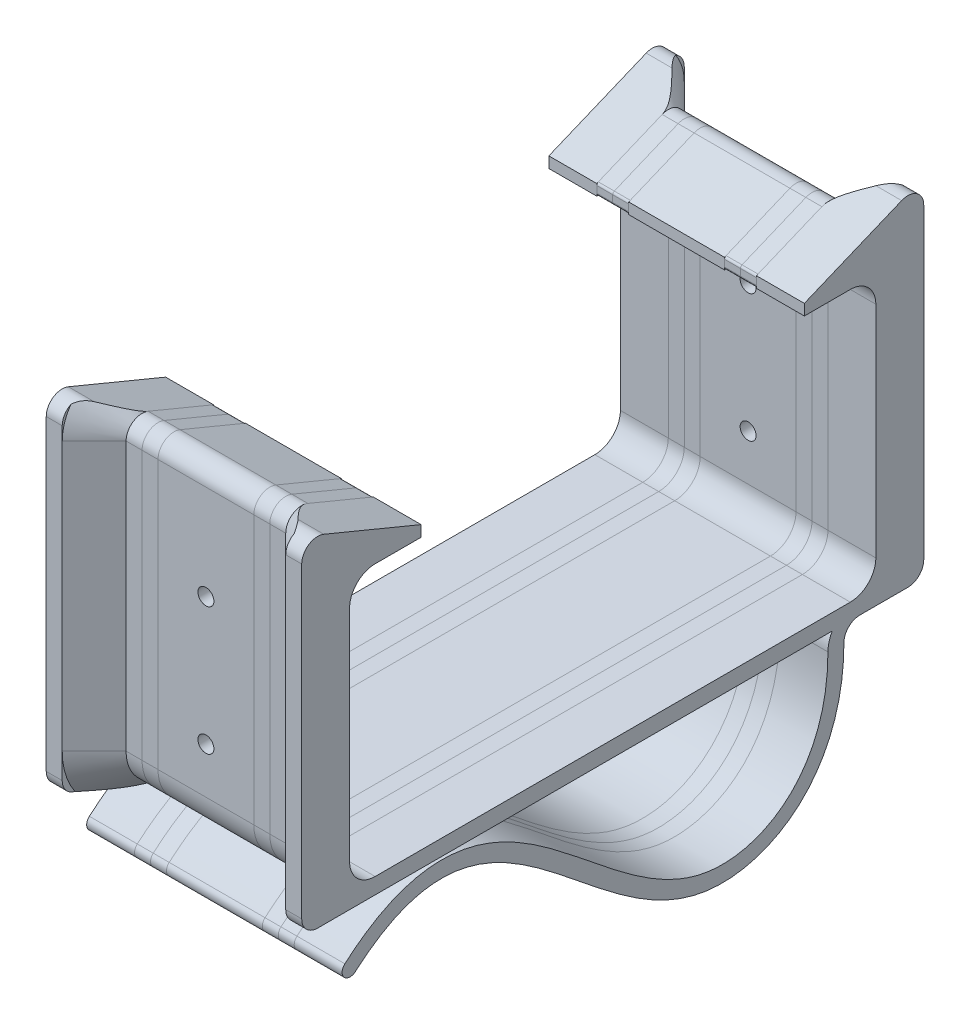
SolidWorks part; units mm, degrees
other "Markup1"
sketch "Sketch7" plane through (-12.7, 17.7179, -30.1625) normal (-0.2414, 0.8298, -0.5031) x (-0.9244, -0.0389, 0.3793)
ref_plane "Front Plane" through (0, 0, 0) normal (0, 0, 1) x (1, 0, 0)
ref_plane "Top Plane" through (0, 0, 0) normal (0, 1, 0) x (1, 0, 0)
ref_plane "Right Plane" through (0, 0, 0) normal (1, 0, 0) x (0, 0, -1)
sketch "Sketch1" plane through (0, 0, 0) normal (1, 0, 0) x (0, 0, -1)
  line L0 (-23.622, -13.462) -> (23.622, -13.462)
  line L1 (-26.162, -10.922) -> (-26.162, 10.922)
  line L2 (-23.622, 13.462) -> (23.622, 13.462)
  line L3 (26.162, -10.922) -> (26.162, 10.922)
  line L4 (-26.162, -13.462) -> (26.162, 13.462) construction
  line L5 (-26.162, 13.462) -> (26.162, -13.462) construction
  arc A0 (-23.622, -13.462) -> (-26.162, -10.922) centre (-23.622, -10.922) cw
  arc A1 (23.622, -13.462) -> (26.162, -10.922) centre (23.622, -10.922) ccw
  arc A2 (23.622, 13.462) -> (26.162, 10.922) centre (23.622, 10.922) cw
  arc A3 (-26.162, 10.922) -> (-23.622, 13.462) centre (-23.622, 10.922) cw
  point P0 (0, 0)
  dimension "D3" = 2.54
  dimension "D1" = 52.324
  dimension "D2" = 26.924
extrude "Extrude-Thin1" add sketch "Sketch1" along normal mid plane 25.4 thin
sketch "Sketch2" plane through (12.7, 0, 0) normal (1, 0, 0) x (0, 0, -1)
  line L0 (23.622, 13.462) -> (-23.622, 13.462) construction
  line L1 (-19.05, 13.462) -> (19.05, 13.462)
  line L2 (-19.05, 13.462) -> (-19.05, 15.0495)
  line L3 (-19.05, 15.0495) -> (19.05, 15.0495)
  line L4 (19.05, 13.462) -> (19.05, 15.0495)
  line L5 (23.622, 15.0495) -> (-23.622, 15.0495) construction
  point P8 (0, 13.462)
  dimension "D1" = 38.1
extrude "Cut-Extrude1" cut sketch "Sketch2" against normal through all
sketch "Sketch3" plane through (12.7, 0, 0) normal (1, 0, 0) x (0, 0, -1)
  line L0 (-27.7495, 10.922) -> (-27.7495, 19.812)
  line L1 (-27.7495, 19.812) -> (-19.05, 19.812)
  line L2 (-19.05, 19.812) -> (-19.05, 13.462)
  line L3 (27.7495, 10.922) -> (27.7495, 19.812)
  line L4 (27.7495, 19.812) -> (19.05, 19.812)
  line L5 (19.05, 19.812) -> (19.05, 13.462)
  line L6 (-19.05, 15.0495) -> (-19.05, 13.462) construction
  line L7 (19.05, 13.462) -> (19.05, 15.0495) construction
  line L8 (-19.05, 13.462) -> (-23.622, 13.462) construction
  line L9 (23.622, 15.0495) -> (19.05, 15.0495) construction
  line L10 (-19.05, 15.0495) -> (-23.622, 15.0495) construction
  line L11 (23.622, 15.0495) -> (19.05, 15.0495)
  line L12 (-19.05, 15.0495) -> (-23.622, 15.0495)
  arc A0 (27.7495, 10.922) -> (23.622, 15.0495) centre (23.622, 10.922) ccw construction
  arc A1 (-23.622, 15.0495) -> (-27.7495, 10.922) centre (-23.622, 10.922) ccw construction
  arc A2 (27.7495, 10.922) -> (23.622, 15.0495) centre (23.622, 10.922) ccw
  arc A3 (-23.622, 15.0495) -> (-27.7495, 10.922) centre (-23.622, 10.922) ccw
  dimension "D1" = 6.35
extrude "Boss-Extrude1" add sketch "Sketch3" against normal through all contours L2 L1 L0 M8 M7 | L4 L5 L3 M15 M14
chamfer "Chamfer1" distance 12.7 angle 22.5 2 edges at (0, 19.812, -19.05) (0, 19.812, 19.05)
sketch "Sketch4" plane through (12.7, 0, 0) normal (1, 0, 0) x (0, 0, -1)
  line L0 (-27.7495, 18.1549) -> (-30.9245, 19.4701)
  line L1 (-27.7495, 18.1549) -> (-27.7495, -10.922) construction
  line L2 (-19.05, 14.5515) -> (-27.7495, 18.1549) construction
  line L3 (-30.9245, 19.4701) -> (-30.9245, -15.0495)
  line L4 (-30.9245, -15.0495) -> (-23.622, -15.0495)
  line L5 (-23.622, -15.0495) -> (23.622, -15.0495) construction
  line L6 (-26.162, 10.922) -> (-26.162, -10.922) construction
  line L7 (0, 0) -> (0, -13.462) construction
  line L8 (-23.622, -13.462) -> (23.622, -13.462) construction
  line L9 (-27.7495, 18.1549) -> (-27.7495, -10.922)
  line L10 (27.7495, 18.1549) -> (27.7495, -10.922)
  line L11 (30.9245, -15.0495) -> (23.622, -15.0495)
  line L12 (30.9245, 19.4701) -> (30.9245, -15.0495)
  line L13 (27.7495, 18.1549) -> (30.9245, 19.4701)
  arc A0 (-27.7495, -10.922) -> (-23.622, -15.0495) centre (-23.622, -10.922) ccw construction
  arc A1 (-27.7495, -10.922) -> (-23.622, -15.0495) centre (-23.622, -10.922) ccw
  arc A2 (27.7495, -10.922) -> (23.622, -15.0495) centre (23.622, -10.922) cw
  dimension "D1" = 4.7625
extrude "Boss-Extrude2" add sketch "Sketch4" against normal blind 1.5875 contours L3 L4 L0 M27 M26 | L13 L11 L12 M12 M29
mirror "Mirror1" about plane through (0, 0, 0) normal (1, 0, 0) of "Boss-Extrude2"
fillet "Fillet1" radius 1.5875 10 edges at (0, 18.1549, 27.7495) (11.9062, -15.0495, 30.9245) (11.9062, 19.4701, 30.9245) (11.9062, 19.4701, -30.9245) (11.9062, -15.0495, -30.9245) (-11.9062, 19.4701, 30.9245) (-11.9062, -15.0495, 30.9245) (0, 18.1549, -27.7495) (-11.9062, 19.4701, -30.9245) (-11.9062, -15.0495, -30.9245)
sketch "Sketch5" plane through (12.7, 0, 0) normal (1, 0, 0) x (0, 0, -1)
  line L0 (-29.337, -15.0495) -> (29.337, -15.0495) construction
  line L2 (26.162, -10.922) -> (26.162, 10.922) construction
  line L6 (-26.162, 10.922) -> (-26.162, -10.922) construction
  arc A0 (24.5745, -15.0495) -> (22.987, -16.637) centre (24.5745, -16.637) ccw
  spline S0 degree 3 poles (22.987, -16.637) (22.987, -27.4714) (1.5119, -40.7912) (-11.8286, -7.8536) (-26.162, -21.1832) knots 0 0 0 0 0.329561 1 1 1 1
  dimension "D1" = 1.5875
  dimension "D2" = 1.5875
extrude "Extrude-Thin2" add sketch "Sketch5" against normal through all thin
fillet "Fillet2" radius 0.7935 2 edges at (0, -21.1832, 26.162) (0, -20.0207, 27.2431)
chamfer "Chamfer2" distance 3.175 angle 45 12 edges at (11.1125, -13.4818, -26.8599) (11.1125, 17.099, -27.044) (11.1125, 2.4285, -27.7495) (-11.1125, -13.4818, -26.8599) (-11.1125, 17.099, -27.044) (-11.1125, 2.4285, -27.7495) (11.1125, 17.099, 27.044) (11.1125, -13.8406, 26.5406) (11.1125, 2.4285, 27.7495) (-11.1125, 17.099, 27.044) (-11.1125, -13.8406, 26.5406) (-11.1125, 2.4285, 27.7495)
sketch "Sketch6" plane through (0, 0, 0) normal (0, 0, 1) x (1, 0, 0)
  line L0 (0, -6.35) -> (0, 6.35) construction
  line L1 (0, 6.35) -> (0, 13.462) construction
  line L3 (0, -6.35) -> (0, -13.462) construction
  line L5 (12.7, -13.462) -> (-12.7, -13.462) construction
  line L6 (12.7, 13.462) -> (-12.7, 13.462) construction
  circle A0 centre (0, 6.35) radius 0.7937
  circle A1 centre (0, -6.35) radius 0.7937
  dimension "D1" = 1.5875
  dimension "D2" = 12.7
extrude "Cut-Extrude2" cut sketch "Sketch6" against normal through all both and the other way through all
ref_plane "Plane1" through (6.35, 0, 0) normal (1, 0, 0) x (0, 0, -1)
ref_plane "Plane2" through (-6.35, 0, 0) normal (1, 0, 0) x (0, 0, -1)
ref_plane "Plane3" through (7.9375, 0, 0) normal (1, 0, 0) x (0, 0, -1)
ref_plane "Plane4" through (4.7625, 0, 0) normal (1, 0, 0) x (0, 0, -1)
ref_plane "Plane5" through (-4.7625, 0, 0) normal (1, 0, 0) x (0, 0, -1)
ref_plane "Plane6" through (-7.9375, 0, 0) normal (1, 0, 0) x (0, 0, -1)
split "Split1" trim tools "Plane6", "Plane2", "Plane5", "Plane4", "Plane1", "Plane3" bodies to split 107 resulting bodies 108 109 110 111 112 113 114
fillet "Fillet3" radius 0.254 4 edges at (-7.1437, 13.462, 19.05) (-7.1437, 13.462, -19.05) (-7.1437, 14.5515, -19.05) (-7.1437, 14.5515, 19.05)
fillet "Fillet4" radius 0.254 4 edges at (-5.5562, 13.462, 19.05) (-5.5562, 13.462, -19.05) (-5.5562, 14.5515, -19.05) (-5.5562, 14.5515, 19.05)
fillet "Fillet5" radius 0.254 4 edges at (5.5562, 13.462, 19.05) (5.5562, 13.462, -19.05) (5.5562, 14.5515, -19.05) (5.5562, 14.5515, 19.05)
fillet "Fillet6" radius 0.254 4 edges at (7.1437, 13.462, 19.05) (7.1437, 13.462, -19.05) (7.1437, 14.5515, -19.05) (7.1437, 14.5515, 19.05)
equation "\"0.031i2n\"=0.031"
